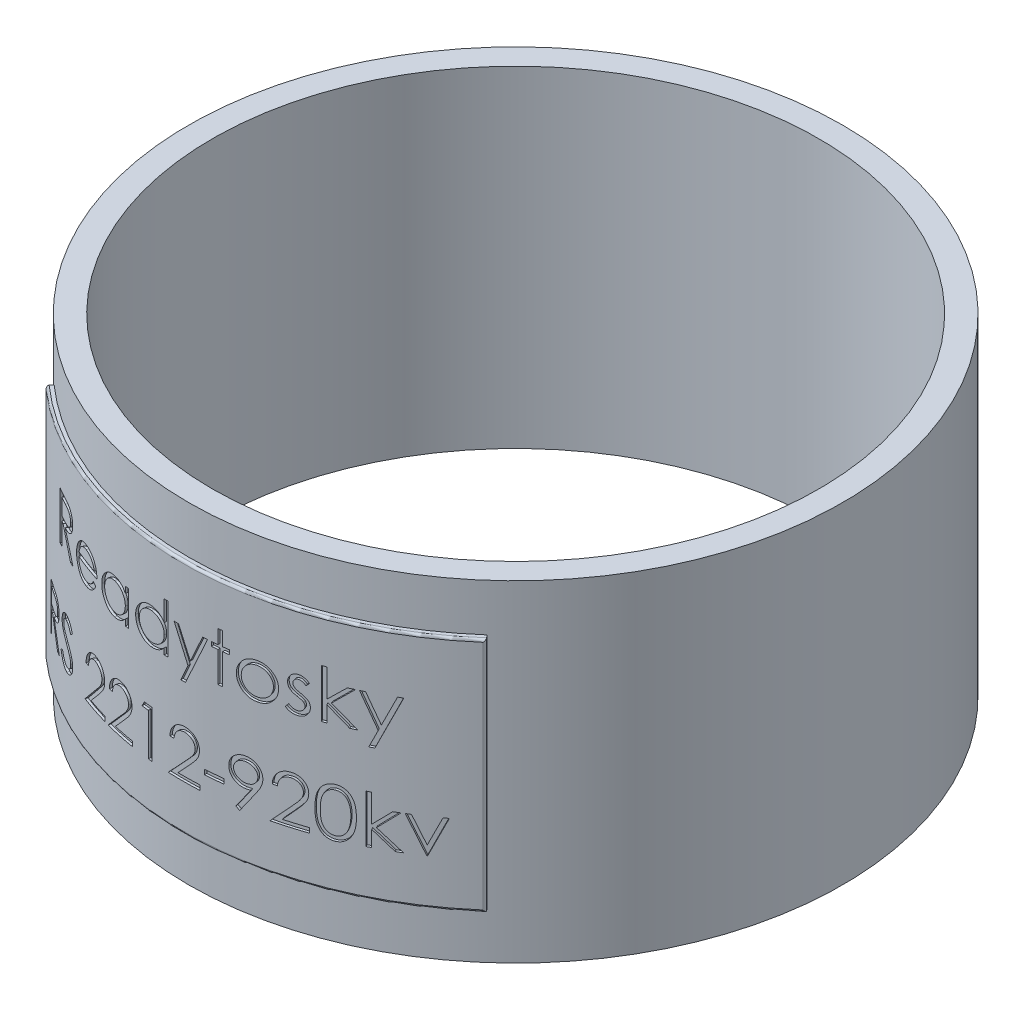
SolidWorks part; units mm, degrees
ref_plane "Plano frontal" through (0, 0, 0) normal (0, 0, 1) x (1, 0, 0)
ref_plane "Plano superior" through (0, 0, 0) normal (0, 1, 0) x (1, 0, 0)
ref_plane "Plano direito" through (0, 0, 0) normal (1, 0, 0) x (0, 0, -1)
sketch "Esboço1" plane through (0, 0, 0) normal (0, 1, 0) x (1, 0, 0)
  circle A0 centre (0, 0) radius 13.825
  circle A1 centre (0, 0) radius 12.825
  dimension "D1" = 1
  dimension "D2" = 25.65
extrude "Ressalto-extrusão1" add sketch "Esboço1" along normal blind 14
sketch "Esboço2" plane through (0, 0, 0) normal (0, 0, 1) x (1, 0, 0)
  line L0 (0, 0) -> (0, 14) construction
  line L1 (12.825, 14) -> (-12.825, 14) construction
  line L3 (-10, 12) -> (10, 12)
  line L4 (-10, 12) -> (-10, 2)
  line L5 (-10, 2) -> (10, 2)
  line L6 (10, 12) -> (10, 2)
  line L7 (-10, 12) -> (10, 2) construction
  line L8 (-10, 2) -> (10, 12) construction
  point P5 (0, 7)
  dimension "D1" = 20
  dimension "D2" = 10
wrap "Envolver1" sketch "Esboço2" wrap type emboss source sketch "Esboço2" thickness 0.25 parameters "D1"=0.25
sketch "Esboço3" plane through (0, 0, 0) normal (0, 0, 1) x (1, 0, 0)
  line L0 (0, 12) -> (0, 2) construction
  line L1 (9.1505, 12) -> (-9.1505, 12) construction
  line L2 (-9.1505, 2) -> (9.1505, 2) construction
  line L3 (-8.3972, 8.1373) -> (8.3972, 8.1373) construction
  line L4 (-9.0827, 3.9309) -> (9.0827, 3.9309) construction
  text T0 "Readytosky" font "Century Gothic" height 2
  text T1 "RS 2212-920kv" font "Century Gothic" height 1.98
  point P9 (0, 8.1373)
  point P12 (0, 3.9309)
wrap "Envolver2" sketch "Esboço3" wrap type deboss source sketch "Esboço3" thickness 0.1 parameters "D1"=0.1
fillet "Filete1" radius 0.1 4 edges at (-9.316, 7, 10.5507) (0, 2, 14.075) (9.316, 7, 10.5507) (0, 12, 14.075)
